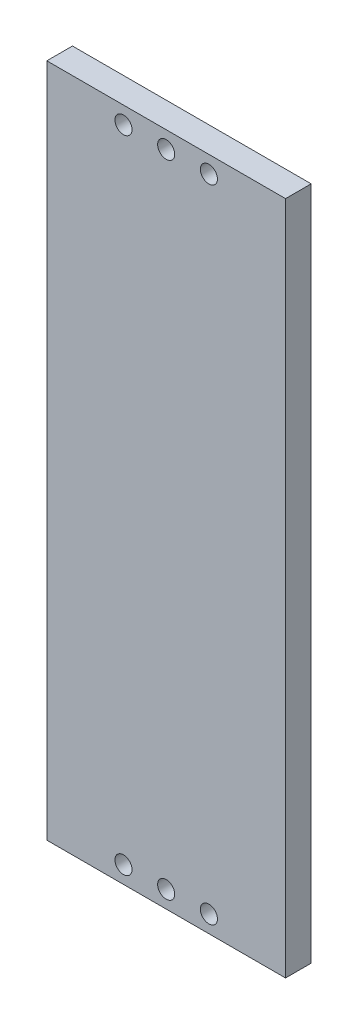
SolidWorks part; units mm, degrees
ref_plane "Front Plane" through (0, 0, 0) normal (0, 0, 1) x (1, 0, 0)
ref_plane "Top Plane" through (0, 0, 0) normal (0, 1, 0) x (1, 0, 0)
ref_plane "Right Plane" through (0, 0, 0) normal (1, 0, 0) x (0, 0, -1)
sketch "Sketch1" plane through (0, 0, 0) normal (0, 0, 1) x (1, 0, 0)
  line L0 (-8.3954, 7) -> (-1.4976, 7)
  line L5 (13.97, 11) -> (13.97, -68) construction
  line L7 (-13.9652, 4) -> (13.97, 4)
  line L8 (1.5024, 7) -> (8.4003, 7)
  line L9 (-8.3954, 1) -> (-1.4976, 1)
  line L10 (1.5024, 1) -> (8.4003, 1)
  line L11 (-8.3954, -5) -> (-1.4976, -5)
  line L12 (1.5024, -5) -> (8.4003, -5)
  line L13 (-8.3954, -11) -> (-1.4976, -11)
  line L14 (1.5024, -11) -> (8.4003, -11)
  line L15 (-8.3954, -17) -> (-1.4976, -17)
  line L16 (1.5024, -17) -> (8.4003, -17)
  line L17 (-8.3954, -23) -> (-1.4976, -23)
  line L18 (1.5024, -23) -> (8.4003, -23)
  line L19 (-8.3954, -29) -> (-1.4976, -29)
  line L20 (1.5024, -29) -> (8.4003, -29)
  line L21 (-8.3954, -35) -> (-1.4976, -35)
  line L22 (1.5024, -35) -> (8.4003, -35)
  line L23 (-8.3954, -41) -> (-1.4976, -41)
  line L24 (1.5024, -41) -> (8.4003, -41)
  line L25 (-8.3954, -47) -> (-1.4976, -47)
  line L26 (1.5024, -47) -> (8.4003, -47)
  line L27 (-8.3954, -53) -> (-1.4976, -53)
  line L28 (1.5024, -53) -> (8.4003, -53)
  line L29 (-8.3954, -59) -> (-1.4976, -59)
  line L30 (1.5024, -59) -> (8.4003, -59)
  line L31 (-8.3954, -65) -> (-1.4976, -65)
  line L32 (1.5024, -65) -> (8.4003, -65)
  line L37 (-13.9652, -2) -> (13.97, -2)
  line L38 (-13.9652, -8) -> (13.97, -8)
  line L39 (-13.9652, -14) -> (13.97, -14)
  line L40 (-13.9652, -20) -> (13.97, -20)
  line L41 (-13.9652, -26) -> (13.97, -26)
  line L42 (-13.9652, -32) -> (13.97, -32)
  line L43 (-13.9652, -38) -> (13.97, -38)
  line L44 (-13.9652, -44) -> (13.97, -44)
  line L45 (-13.9652, -50) -> (13.97, -50)
  line L46 (-13.9652, -56) -> (13.97, -56)
  line L47 (-13.9652, -62) -> (13.97, -62)
  point P0 (0, 0)
  point P1 (0, 0)
  point P2 (0, 0)
  point P3 (13.97, -2)
sketch "Croquis1" plane through (0, 0, 0) normal (0, 0, 1) x (1, 0, 0)
  line L0 (1.5024, 7) -> (8.4003, 7) construction
  line L1 (-13.97, 11) -> (13.97, 11)
  line L2 (-13.97, 11) -> (-13.97, -68)
  line L3 (-13.97, -68) -> (13.97, -68)
  line L4 (13.97, 11) -> (13.97, -68)
  line L5 (13.97, -28.5) -> (-13.97, -28.5) construction
  circle A1 centre (0, -66) radius 1
  circle A2 centre (5, -66) radius 1
  circle A3 centre (-5, -66) radius 1
  circle A7 centre (5, 9) radius 1
  circle A8 centre (0, 9) radius 1
  circle A9 centre (-5, 9) radius 1
  point P4 (0, 11)
  point P8 (4.9513, 7)
extrude "Saliente-Extruir2" add sketch "Croquis1" along normal blind 3
equation "\"T\" = 3'Material thickness (mm)"
equation "\"k\"= 0.2'kerf mm"
equation "\"theta\"= 180'Total bend angle DEG"
equation "\"theta_rad\"= 3.14159 * \"theta\" / 180'Total bend angle RAD"
equation "\"n\" = round ( ( \"theta_rad\" / ( 3.14159 / 4 - arccos ( ( \"k\" + \"T\" ) / ( 2 * sqr ( ( \"T\" ^ 2 ) / 2 ) ) ) ) ) / 2 )'Minimum number of columns of torsional links"
equation "\"tallow\"= 20'Torsional Stress Allowed MPA"
equation "\"G\"= 900'Torsional Modulus of the material (Pa)"
equation "\"l\"= 0.676125 * ( \"theta_rad\" * \"G\" * \"T\" ) / ( \"tallow\" * \"n\" )"
equation "\"D1@Sketch1\"=\"T\""
equation "\"D2@Sketch1\"=\"l\""
equation "\"D3@Sketch1\"=\"l\""
equation "\"D4@Sketch1\"=\"T\""
equation "\"D7@Sketch1\"=\"n\"/2 + 1"
equation "\"D9@Sketch1\"=\"n\"/2"
equation "\"D11@Sketch1\"=\"T\"*2"
equation "\"D10@Sketch1\"=\"T\"*2"
equation "\"distancia_rectangulo\"= 27.94'Ancho del rectangulo"
equation "\"D1@Croquis1\"=\"distancia_rectangulo\""
equation "\"largo_rectangulo\"= \"T\" * \"n\" + 10'altura total del rectangulo"
equation "\"D2@Croquis1\"=\"largo_rectangulo\""
equation "\"D1@Saliente-Extruir2\"=\"T\""
equation "\"D9@Croquis1\"=\"largo_rectangulo\"/2"
